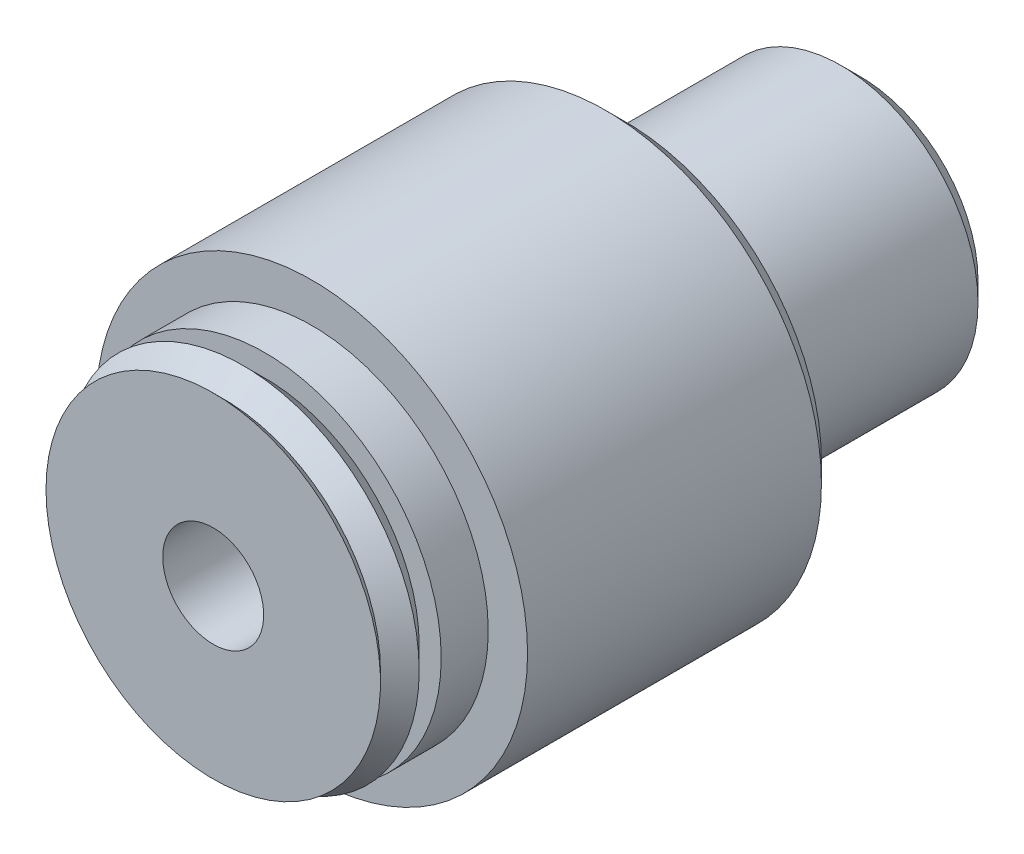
SolidWorks part; units mm, degrees
ref_plane "Front" through (0, 0, 0) normal (0, 0, 1) x (1, 0, 0)
ref_plane "Top" through (0, 0, 0) normal (0, 1, 0) x (1, 0, 0)
ref_plane "Right" through (0, 0, 0) normal (1, 0, 0) x (0, 0, -1)
ref_plane "Body Plane" through (0, 0, -3.9982) normal (0, 0, 1) x (1, 0, 0)
sketch "Sketch1" plane through (0, 0, 0) normal (1, 0, 0) x (0, 0, -1)
  line L0 (71.2941, 0) -> (-67.6458, 0) construction
  line L1 (0, 0) -> (0, 6.7754)
  line L2 (0, 6.7754) -> (0.4166, 6.3589)
  line L3 (0.4166, 6.3589) -> (1.2014, 7.1437)
  line L4 (1.2014, 7.1437) -> (2.0932, 6.252)
  line L5 (2.0932, 6.252) -> (2.0932, 7.1437)
  line L6 (2.0932, 7.1437) -> (3.9982, 7.1437)
  line L7 (3.9982, 7.1437) -> (3.9982, 0)
  line L8 (3.9982, 0) -> (0, 0)
  dimension "D1" = 45
  dimension "D2" = 7.1437
  dimension "外径" = 7.1437
  dimension "D4" = 0.8918
  dimension "D5" = 1.2014
  dimension "D6" = 6.7754
  dimension "Front Length" = 1.905
revolve "Base" add sketch "Sketch1" angle 360 about L0
sketch "Sketch4" plane through (0, 0, -3.9982) normal (0, 0, 1) x (1, 0, 0)
  circle A0 centre (0, 0) radius 8.7376
  dimension "D1" = 17.4752
extrude "Double Acting Stud Body" add sketch "Sketch4" against normal blind 12.7
sketch "Sketch5" plane through (0, 0, -16.6982) normal (0, 0, -1) x (-1, 0, 0)
  circle A0 centre (0, 0) radius 5.5562
  dimension "D1" = 11.1125
extrude "Double Acting Stud Body 2" add sketch "Sketch5" along normal blind 9.525
chamfer "Double Acting Stud Chamfer" distance 0.7937 angle 45 2 edges at (8.7376, 0, -16.6982) (-5.5562, 0, -26.2232)
sketch "Sketch8" plane through (0, 0, 0) normal (1, 0, 0) x (0, 0, -1)
  line L0 (15.9045, 0) -> (3.9982, 0) construction
  line L1 (3.9982, 8.7376) -> (3.9982, -8.7376) construction
  circle A0 centre (7.1732, 0) radius 2.032
  dimension "D1" = 4.064
  dimension "D2" = 3.175
extrude "Double Acting Stud Port A1" cut sketch "Sketch8" against normal through all
sketch "Sketch3" plane through (0, 0, 0) normal (0, 0, -1) x (-1, 0, 0)
  circle A0 centre (0, 0) radius 2.0447
  dimension "杆径" = 4.0894
extrude "Hole Cut" cut sketch "Sketch3" along normal through all
